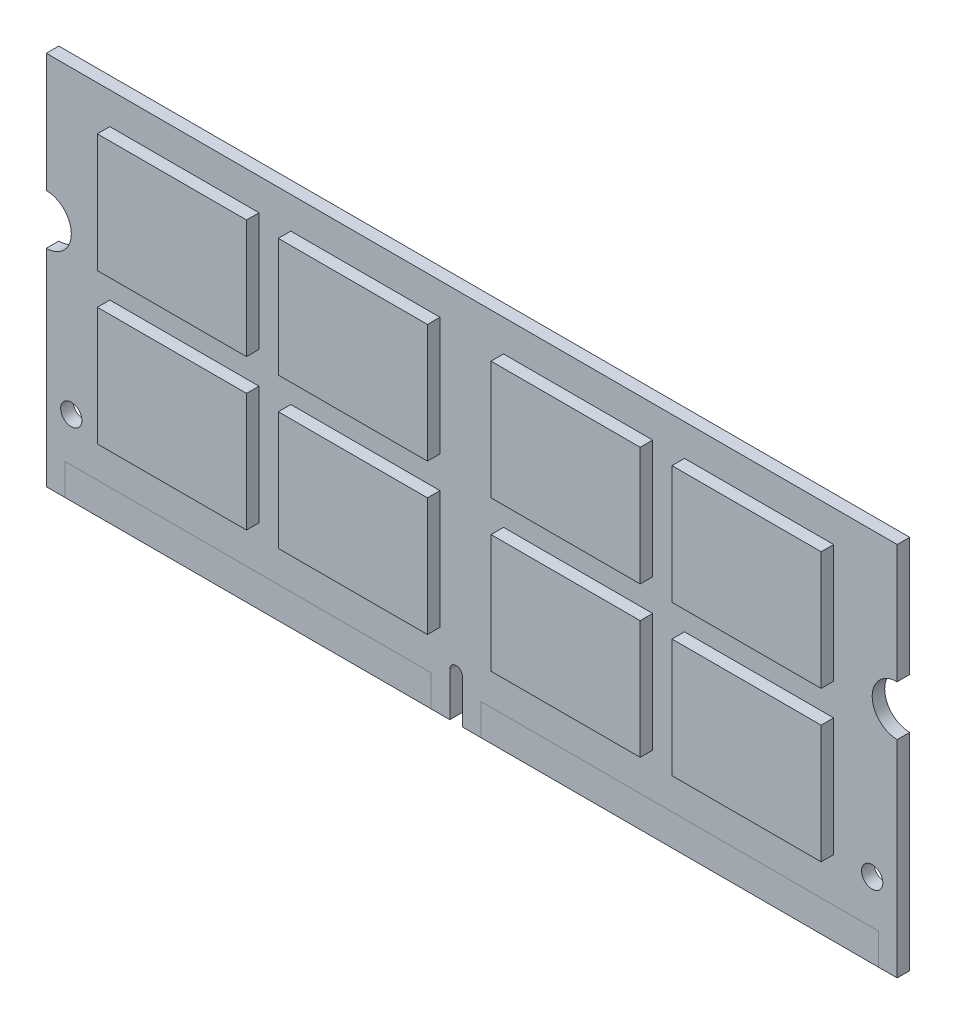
SolidWorks part; units mm, degrees
ref_plane "Front Plane" through (0, 0, 0) normal (0, 0, 1) x (1, 0, 0)
ref_plane "Top Plane" through (0, 0, 0) normal (0, 1, 0) x (1, 0, 0)
ref_plane "Right Plane" through (0, 0, 0) normal (1, 0, 0) x (0, 0, -1)
sketch "Sketch1" plane through (0, 0, 0) normal (0, 0, 1) x (1, 0, 0)
  line L0 (34, 15) -> (-34, -15) construction
  line L1 (-34, 15) -> (34, 15)
  line L2 (-34, 15) -> (-34, -15)
  line L3 (-34, -15) -> (34, -15)
  line L4 (34, 15) -> (34, -15)
  dimension "D1" = 68
  dimension "D2" = 30
extrude "MAIN BOARD" add sketch "Sketch1" along normal mid plane 1
sketch "Sketch2" plane through (0, 0, 0.5) normal (0, 0, 1) x (1, 0, 0)
  line L0 (-34, 15) -> (-34, -15) construction
  line L1 (-34, 5.5) -> (-34, 1.5)
  line L2 (34, 15) -> (-34, 15) construction
  line L3 (0, -1000) -> (0, 49000) construction
  line L4 (34, 5.5) -> (34, 1.5)
  arc A0 (-34, 5.5) -> (-34, 1.5) centre (-34, 3.5) cw
  arc A1 (34, 5.5) -> (34, 1.5) centre (34, 3.5) ccw
  dimension "D1" = 9.5
  dimension "D2" = 4
  dimension "D3" = 2
extrude "MOUNTING CLIP GROOVES" cut sketch "Sketch2" against normal through all
hole_wizard "M1.7 (1.7) LOCATING PIN HOLES" positions "Sketch4" profile "Sketch3" hole size "M1.7" standard "Ansi Metric"
sketch "Sketch4" plane through (0, 0, 0.5) normal (0, 0, 1) x (1, 0, 0)
  line L0 (0, -1000) -> (0, 49000) construction
  line L1 (-34, 1.5) -> (-34, -15) construction
  line L2 (-34, -15) -> (34, -15) construction
  point P1 (32, -9)
  point P5 (-32, -9)
  dimension "D1" = 2
  dimension "D2" = 6
sketch "Sketch3" plane through (-32, -9, 0.5) normal (1, 0, 0) x (0, -1, 0)
  line L0 (0, 0) -> (0, 1)
  line L1 (0, 1) -> (0.85, 1)
  line L2 (0.85, 1) -> (0.85, 0)
  line L5 (0.85, 0) -> (0, 0)
  line L11 (0, -6.35) -> (0, 107.95) construction
  dimension "Thru Hole Dia." = 1.7
  dimension "Thru Hole Depth" = 1
sketch "Sketch5" plane through (0, 0, 0.5) normal (0, 0, 1) x (1, 0, 0)
  line L0 (-1.75, -15) -> (-1.75, -11.5)
  line L1 (-34, -15) -> (34, -15) construction
  line L2 (-0.75, -11.5) -> (-0.75, -15)
  line L3 (-0.75, -15) -> (-1.75, -15)
  line L6 (-1.25, -15) -> (-1.25, -11.5) construction
  line L7 (0, 0) -> (0, 15) construction
  line L8 (34, 15) -> (-34, 15) construction
  arc A0 (-1.75, -11.5) -> (-0.75, -11.5) centre (-1.25, -11.5) cw
  dimension "D3" = 4
  dimension "D1" = 1.25
  dimension "D2" = 1
extrude "LOCATING SLOT" cut sketch "Sketch5" against normal through all
sketch "Sketch7" plane through (0, 0, 0.5) normal (0, 0, 1) x (1, 0, 0)
  line L0 (-34, -15) -> (-1.75, -15) construction
  line L1 (-32.5, -15) -> (-3.25, -15)
  line L2 (-32.5, -15) -> (-32.5, -12.5)
  line L3 (-32.5, -12.5) -> (-3.25, -12.5)
  line L4 (-3.25, -15) -> (-3.25, -12.5)
  line L5 (-34, 1.5) -> (-34, -15) construction
  line L6 (-1.75, -11.5) -> (-1.75, -15) construction
  dimension "D1" = 1.5
  dimension "D2" = 2.5
  dimension "D3" = 1.5
sketch "Sketch8" plane through (0, 0, 0.5) normal (0, 0, 1) x (1, 0, 0)
  line L0 (-0.75, -15) -> (34, -15) construction
  line L1 (0.75, -15) -> (32.5, -15)
  line L2 (0.75, -15) -> (0.75, -12.5)
  line L3 (0.75, -12.5) -> (32.5, -12.5)
  line L4 (32.5, -15) -> (32.5, -12.5)
  line L5 (-32.5, -12.5) -> (-3.25, -12.5) construction
  line L6 (34, -15) -> (34, 1.5) construction
  line L7 (-0.75, -15) -> (-0.75, -11.5) construction
  dimension "D1" = 1.5
  dimension "D2" = 1.5
sketch "Sketch9" plane through (0, 0, 0.5) normal (0, 0, 1) x (1, 0, 0)
  line L0 (0, 15) -> (0, 0) construction
  line L1 (34, 15) -> (-34, 15) construction
  line L2 (-28.92, -9) -> (-32, -9) construction
  line L3 (-28.92, 12.46) -> (-17, 12.46)
  line L4 (-28.92, 12.46) -> (-28.92, 3)
  line L5 (-28.92, 3) -> (-17, 3)
  line L6 (-17, 12.46) -> (-17, 3)
  line L7 (-14.46, 12.46) -> (-2.54, 12.46)
  line L8 (-14.46, 12.46) -> (-14.46, 3)
  line L9 (-14.46, 3) -> (-2.54, 3)
  line L10 (-2.54, 12.46) -> (-2.54, 3)
  line L11 (-28.92, 0.46) -> (-17, 0.46)
  line L12 (-28.92, 0.46) -> (-28.92, -9)
  line L13 (-28.92, -9) -> (-17, -9)
  line L14 (-17, 0.46) -> (-17, -9)
  line L15 (-14.46, 0.46) -> (-2.54, 0.46)
  line L16 (-14.46, 0.46) -> (-14.46, -9)
  line L17 (-14.46, -9) -> (-2.54, -9)
  line L18 (-2.54, 0.46) -> (-2.54, -9)
  line L19 (-34, 15) -> (-34, 5.5) construction
  line L20 (2.54, 0.46) -> (2.54, -9)
  line L21 (14.46, -9) -> (2.54, -9)
  line L22 (14.46, 0.46) -> (14.46, -9)
  line L23 (14.46, 0.46) -> (2.54, 0.46)
  line L24 (17, 0.46) -> (17, -9)
  line L25 (28.92, -9) -> (17, -9)
  line L26 (28.92, 0.46) -> (28.92, -9)
  line L27 (28.92, 0.46) -> (17, 0.46)
  line L28 (2.54, 12.46) -> (2.54, 3)
  line L29 (14.46, 3) -> (2.54, 3)
  line L30 (14.46, 12.46) -> (14.46, 3)
  line L31 (14.46, 12.46) -> (2.54, 12.46)
  line L32 (17, 12.46) -> (17, 3)
  line L33 (28.92, 3) -> (17, 3)
  line L34 (28.92, 12.46) -> (28.92, 3)
  line L35 (28.92, 12.46) -> (17, 12.46)
  dimension "D1" = 2.54
  dimension "D2" = 2.54
  dimension "D3" = 2.54
  dimension "D4" = 2.54
  dimension "D5" = 5.08
extrude "Boss-Extrude1" add sketch "Sketch9" along normal blind 1 and the other way offset from surface (2 mm away) 1
sketch "Sketch10" plane through (0, 0, 0.5) normal (0, 0, 1) x (1, 0, 0)
  line L0 (34, 5.5) -> (34, 15) construction
  line L1 (-34, 15) -> (34, 15)
  line L2 (-34, 15) -> (-34, 24.37)
  line L3 (-34, 24.37) -> (34, 24.37)
  line L4 (34, 15) -> (34, 24.37)
  line L5 (-34, -15) -> (-32.5, -15) construction
  line L6 (-22.8473, 19.798) -> (22.8473, 19.798) construction
  line L7 (0, 19.798) -> (0, 24.37) construction
  circle A0 centre (-22.8473, 19.798) radius 1.2446
  circle A1 centre (22.8473, 19.798) radius 1.2446
  dimension "D2" = 2.4892
  dimension "D3" = 45.6946
  dimension "D4" = 34.798
  dimension "D1" = 39.37
extrude "Boss-Extrude2" add sketch "Sketch10" against normal up to surface (1 mm away)
sketch "Sketch11" plane through (0, 0, -1.5) normal (0, 0, -1) x (-1, 0, 0)
  line L2 (-34, 24.37) -> (34, 24.37)
  line L3 (-34, 24.37) -> (-34, 15)
  line L4 (-34, 15) -> (34, 15)
  line L5 (34, 24.37) -> (34, 15)
  line L7 (-0.75, -15) -> (-32.5, -15) construction
  dimension "D1" = 30
extrude "Cut-Extrude1" cut sketch "Sketch11" against normal through all
